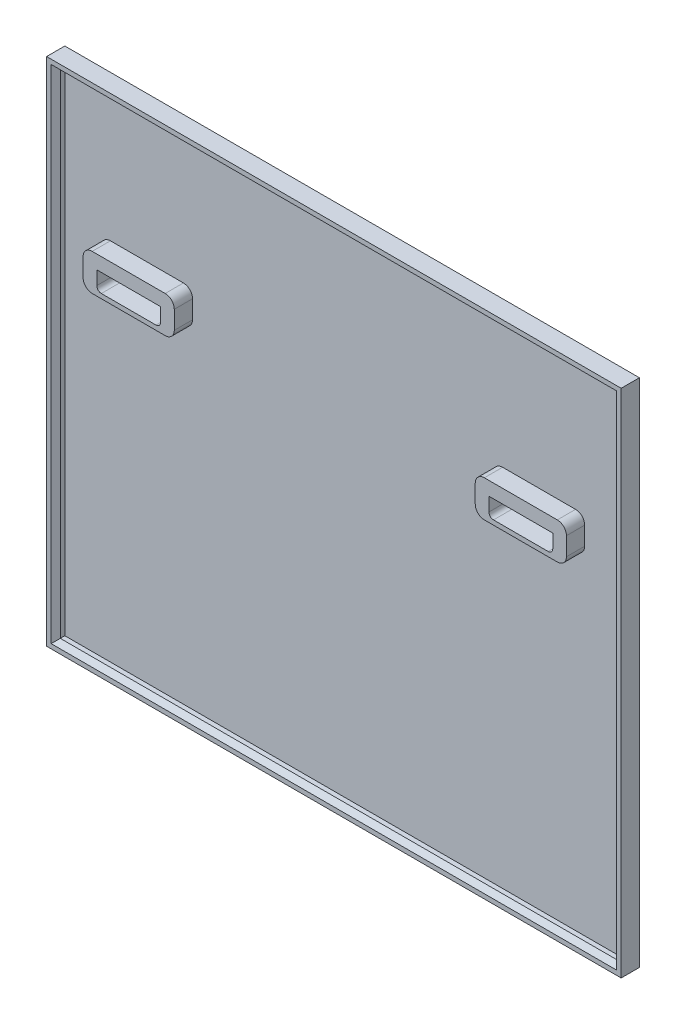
SolidWorks part; units mm, degrees
ref_plane "前基準面" through (0, 0, 0) normal (0, 0, 1) x (1, 0, 0)
ref_plane "上基準面" through (0, 0, 0) normal (0, 1, 0) x (1, 0, 0)
ref_plane "右基準面" through (0, 0, 0) normal (1, 0, 0) x (0, 0, -1)
sketch "草圖1" plane through (0, 0, 0) normal (0, 0, 1) x (1, 0, 0)
  line L1 (0, 0) -> (630, 0)
  line L2 (0, 0) -> (0, -560)
  line L3 (0, -560) -> (630, -560)
  line L4 (630, 0) -> (630, -560)
  dimension "D1" = 630
  dimension "D2" = 560
extrude "填料-伸長1" add sketch "草圖1" along normal blind 20
shell "薄殼2" thickness 10
shell "薄殼4" thickness 10
chamfer "導角1" distance 5 angle 45 4 edges at (315, -550, 20) (620, -280, 20) (10, -280, 20) (315, -10, 20)
sketch "草圖2" plane through (0, 0, 10) normal (0, 0, 1) x (1, 0, 0)
  line L0 (0, 0) -> (0, -560) construction
  line L1 (60, -150) -> (140, -150)
  line L2 (50, -160) -> (50, -180)
  line L3 (60, -190) -> (140, -190)
  line L4 (150, -160) -> (150, -180)
  line L5 (490, -150) -> (570, -150)
  line L6 (480, -160) -> (480, -180)
  line L7 (490, -190) -> (570, -190)
  line L8 (580, -160) -> (580, -180)
  line L9 (630, 0) -> (0, 0) construction
  line L10 (630, -560) -> (630, 0) construction
  line L11 (630, 0) -> (0, 0) construction
  arc A0 (150, -180) -> (140, -190) centre (140, -180) cw
  arc A1 (150, -160) -> (140, -150) centre (140, -160) ccw
  arc A2 (50, -180) -> (60, -190) centre (60, -180) ccw
  arc A3 (60, -150) -> (50, -160) centre (60, -160) ccw
  arc A4 (580, -180) -> (570, -190) centre (570, -180) cw
  arc A5 (580, -160) -> (570, -150) centre (570, -160) ccw
  arc A6 (480, -180) -> (490, -190) centre (490, -180) ccw
  arc A7 (480, -160) -> (490, -150) centre (490, -160) cw
  point P16 (150, -150)
  point P19 (50, -190)
  point P22 (50, -150)
  point P27 (580, -150)
  point P30 (480, -190)
  point P33 (480, -150)
  dimension "D8" = 10
  dimension "D9" = 10
  dimension "D1" = 100
  dimension "D2" = 100
  dimension "D3" = 40
  dimension "D4" = 40
  dimension "D5" = 50
  dimension "D6" = 50
  dimension "D7" = 150
  dimension "D10" = 150
extrude "填料-伸長2" add sketch "草圖2" along normal blind 20
sketch "草圖3" plane through (0, 0, 30) normal (0, 0, 1) x (1, 0, 0)
  line L0 (50, -160) -> (50, -180) construction
  line L1 (65, -165) -> (135, -165)
  line L2 (65, -165) -> (65, -180)
  line L3 (70, -185) -> (130, -185)
  line L4 (135, -165) -> (135, -180)
  line L5 (495, -165) -> (565, -165)
  line L6 (495, -165) -> (495, -180)
  line L7 (500, -185) -> (560, -185)
  line L8 (565, -165) -> (565, -180)
  line L9 (480, -160) -> (480, -180) construction
  line L10 (140, -150) -> (60, -150) construction
  line L11 (570, -150) -> (490, -150) construction
  arc A0 (565, -180) -> (560, -185) centre (560, -180) cw
  arc A1 (495, -180) -> (500, -185) centre (500, -180) ccw
  arc A2 (135, -180) -> (130, -185) centre (130, -180) cw
  arc A3 (65, -180) -> (70, -185) centre (70, -180) ccw
  point P21 (495, -185)
  point P26 (65, -185)
  dimension "D9" = 5
  dimension "D1" = 70
  dimension "D2" = 70
  dimension "D3" = 20
  dimension "D4" = 20
  dimension "D5" = 15
  dimension "D6" = 15
  dimension "D7" = 15
  dimension "D8" = 15
extrude "除料-伸長1" cut sketch "草圖3" against normal blind 20
